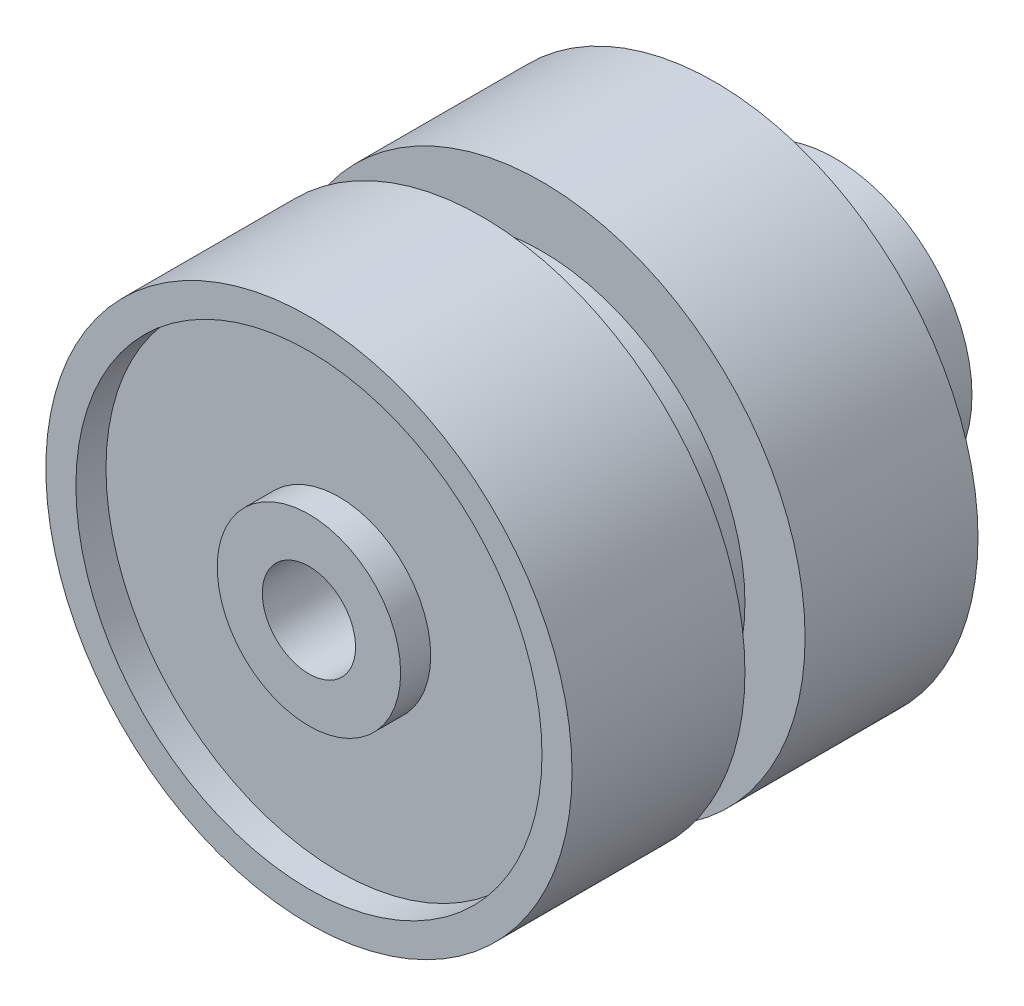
SolidWorks part; units mm, degrees
ref_plane "Plan de face" through (0, 0, 0) normal (0, 0, 1) x (1, 0, 0)
ref_plane "Plan de dessus" through (0, 0, 0) normal (0, 1, 0) x (1, 0, 0)
ref_plane "Plan de droite" through (0, 0, 0) normal (1, 0, 0) x (0, 0, -1)
sketch "Esquisse2" plane through (0, 0, 0) normal (1, 0, 0) x (0, 0, -1)
  line L0 (-6.75, 8.75) -> (-6.75, 1.55)
  line L1 (-6.75, 1.55) -> (6.75, 1.55)
  line L2 (6.75, 1.55) -> (6.75, 8.75)
  line L3 (6.75, 8.75) -> (1, 8.75)
  line L4 (1, 8.75) -> (1, 6.75)
  line L5 (1, 6.75) -> (-1, 6.75)
  line L6 (-1, 6.75) -> (-1, 8.75)
  line L7 (-1, 8.75) -> (-6.75, 8.75)
  line L8 (-15.7878, 0) -> (49984.2122, 0) construction
  dimension "D1" = 2
  dimension "D2" = 2
  dimension "D3" = 13.5
  dimension "D4" = 8.75
  dimension "D5" = 1.55
  dimension "D6" = 6.75
revolve "Révolution1" add sketch "Esquisse2" angle 360 about L8
sketch "Esquisse3" plane through (0, 0, 6.75) normal (0, 0, 1) x (1, 0, 0)
  circle A0 centre (0, 0) radius 7.75
  circle A1 centre (0, 0) radius 3.05
  circle A2 centre (0, 0) radius 1.55 construction
  circle A3 centre (0, 0) radius 8.75 construction
  dimension "D1" = 1.5
  dimension "D2" = 1
extrude "Enlèv. mat.-Extru.1" cut sketch "Esquisse3" against normal blind 1
sketch "Esquisse4" plane through (0, 0, -6.75) normal (0, 0, -1) x (-1, 0, 0)
  circle A0 centre (0, 0) radius 1.55
  circle A1 centre (0, 0) radius 4.55
  circle A2 centre (0, 0) radius 1.55 construction
  dimension "D1" = 3
extrude "Boss.-Extru.1" add sketch "Esquisse4" along normal blind 4
